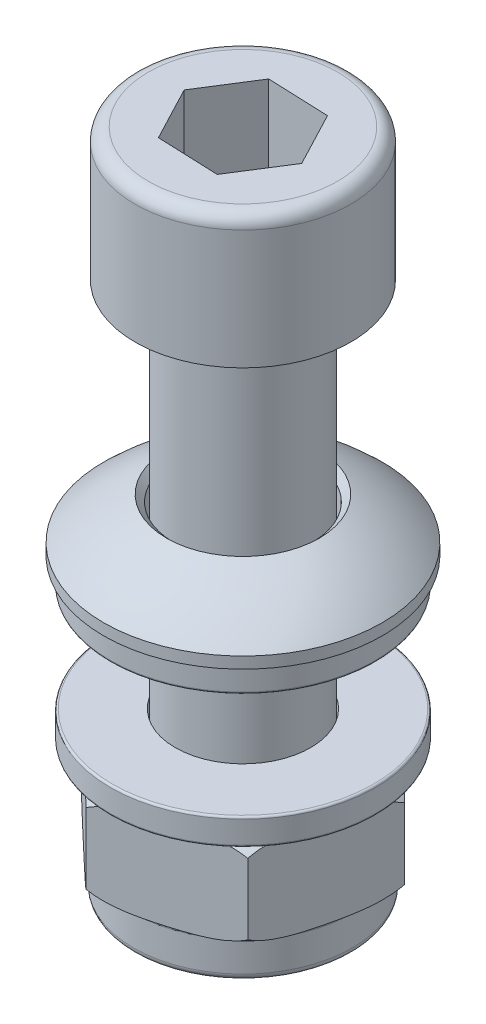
SolidWorks part; units mm, degrees
ref_plane "Plan de face" through (0, 0, 0) normal (0, 0, 1) x (1, 0, 0)
ref_plane "Plan de dessus" through (0, 0, 0) normal (0, 1, 0) x (1, 0, 0)
ref_plane "Plan de droite" through (0, 0, 0) normal (1, 0, 0) x (0, 0, -1)
sketch "Esquisse1" plane through (0, 0, 0) normal (0, 0, 1) x (1, 0, 0)
  line L0 (0, 0) -> (0, -40)
  line L1 (0, -40) -> (-4.4, -40)
  line L2 (-4.4, -40) -> (-5, -39.4)
  line L3 (-5, -39.4) -> (-5, 0)
  line L4 (-5, 2.8868) -> (-5, 10)
  line L5 (-5, 10) -> (-7.135, 10)
  line L6 (-8.135, 9) -> (-8.135, 0)
  line L7 (-5, 2.8868) -> (0, 0)
  line L8 (-8.135, 0) -> (-5, 0)
  arc A0 (-7.135, 10) -> (-8.135, 9) centre (-7.135, 9) ccw
  dimension "D5" = 8.135
  dimension "D3" = 10
  dimension "D6" = 1
  dimension "D1" = 60
  dimension "D2" = 5
  dimension "D4" = 5
  dimension "D8" = 45
  dimension "D9" = 0.6
  dimension "D11" = 40
revolve "Révolution1" add sketch "Esquisse1" angle 360 about L0
sketch "Esquisse2" plane through (0, 10, 0) normal (0, 1, 0) x (1, 0, 0)
  line L1 (-2.1473, 4.0893) -> (-4.6151, 0.185)
  line L2 (-4.6151, 0.185) -> (-2.4678, -3.9043)
  line L3 (-2.4678, -3.9043) -> (2.1473, -4.0893)
  line L4 (2.1473, -4.0893) -> (4.6151, -0.185)
  line L5 (4.6151, -0.185) -> (2.4678, 3.9043)
  line L6 (2.4678, 3.9043) -> (-2.1473, 4.0893)
  circle A0 centre (0, 0) radius 4 construction
  circle A2 centre (0, 0) radius 7.135 construction
  circle A3 centre (0, 0) radius 7.135
  dimension "D2" = 8
extrude "Boss.-Extru.1" add sketch "Esquisse2" against normal up to surface (10 mm away)
sketch "Esquisse4" plane through (0, 0, 0) normal (0, 0, 1) x (1, 0, 0)
  line L0 (0, 0) -> (0, -18.2878) construction
  line L1 (5.1, -28) -> (9.85, -28)
  line L2 (5.1, -28) -> (5.1, -30)
  line L3 (5.1, -30) -> (9.85, -30)
  line L4 (10, -28.15) -> (10, -29.85)
  arc A0 (9.85, -30) -> (10, -29.85) centre (9.85, -29.85) ccw
  arc A1 (9.85, -28) -> (10, -28.15) centre (9.85, -28.15) cw
  dimension "D4" = 0.15
  dimension "D1" = 5.1
  dimension "D2" = 2
  dimension "D3" = 10
  dimension "D5" = 28
revolve "Révolution2" add sketch "Esquisse4" angle 360 about L0
sketch "Esquisse3" plane through (0, 0, 0) normal (0, 0, 1) x (1, 0, 0)
  line L1 (5.25, -30) -> (8, -30)
  line L2 (5, -30.25) -> (5, -39.75)
  line L3 (0, 0) -> (0, -17.1274) construction
  line L4 (8, -30) -> (8, -37) construction
  line L5 (6.75, -40) -> (6.75, -39.75)
  line L6 (5, -30.25) -> (5.25, -30)
  line L7 (8.25, -37.24) -> (8.25, -39.5)
  line L8 (7.75, -40) -> (6.75, -40)
  line L9 (-9.85, -30) -> (9.85, -30) construction
  line L10 (6.75, -39.75) -> (5, -39.75)
  line L11 (10.8, -33.5) -> (8, -33.5) construction
  line L12 (8, -33.5) -> (5.2, -33.5) construction
  line L13 (5, -39.4) -> (5, 0) construction
  arc A0 (8.25, -37.24) -> (8.4855, -36.947) centre (8.55, -37.24) cw
  arc A1 (8.25, -39.5) -> (7.75, -40) centre (7.75, -39.5) cw
  ellipse E0 centre (8, -33.5) end of major axis (8, -30) minor radius 2.8 (8.4855, -36.947) -> (8, -30) ccw
  point P0 (5, -30)
  point P15 (8.25, -40)
  dimension "D6" = 0.5
  dimension "D7" = 3.25
  dimension "D8" = 0.3
  dimension "D1" = 7
  dimension "D2" = 10
  dimension "D3" = 8
  dimension "D4" = 9.75
  dimension "D5" = 1.75
  dimension "D10" = 2.8
revolve "Révolution3" add sketch "Esquisse3" angle 360 about L3
sketch "Esquisse5" plane through (0, -28, 0) normal (0, 1, 0) x (1, 0, 0)
  line L1 (-9.4108, -2.7876) -> (-2.2913, -9.5438)
  line L2 (-2.2913, -9.5438) -> (7.1195, -6.7562)
  line L3 (7.1195, -6.7562) -> (9.4108, 2.7876)
  line L4 (9.4108, 2.7876) -> (2.2913, 9.5438)
  line L5 (2.2913, 9.5438) -> (-7.1195, 6.7562)
  line L6 (-7.1195, 6.7562) -> (-9.4108, -2.7876)
  circle A0 centre (0, 0) radius 8.5 construction
  circle A1 centre (0, 0) radius 16.9017
  dimension "D1" = 17
extrude "Enlèv. mat.-Extru.1" cut sketch "Esquisse5" against normal blind 10
pattern_linear "Répétition linéaire1" count 2 spacing 10 along (0, 1, 0)
sketch "Esquisse6" plane through (0, 0, 0) normal (0, 0, 1) x (1, 0, 0)
  line L0 (-6.05, -18) -> (-10.5, -18)
  line L1 (9.85, -18) -> (-9.85, -18) construction
  line L2 (-10.5, -18) -> (-10.5, -17.142)
  line L3 (-5.25, -17.2) -> (-6.05, -18)
  line L4 (-5.25, -17.2) -> (-5.25, -14.5)
  line L5 (-5.25, -14.5) -> (-5.75, -14)
  line L6 (0, -18.15) -> (0, -33.6526) construction
  line L7 (10, -18.15) -> (-10, -18.15) construction
  arc A0 (-5.75, -14) -> (-10.5, -17.142) centre (0, -27.8542) ccw
  point P0 (-5.25, -18)
  dimension "D1" = 30
  dimension "D2" = 4
  dimension "D3" = 5.25
  dimension "D4" = 135
  dimension "D5" = 0.5
  dimension "D6" = 10.5
revolve "Révolution4" add sketch "Esquisse6" angle 360 mid plane about L6
